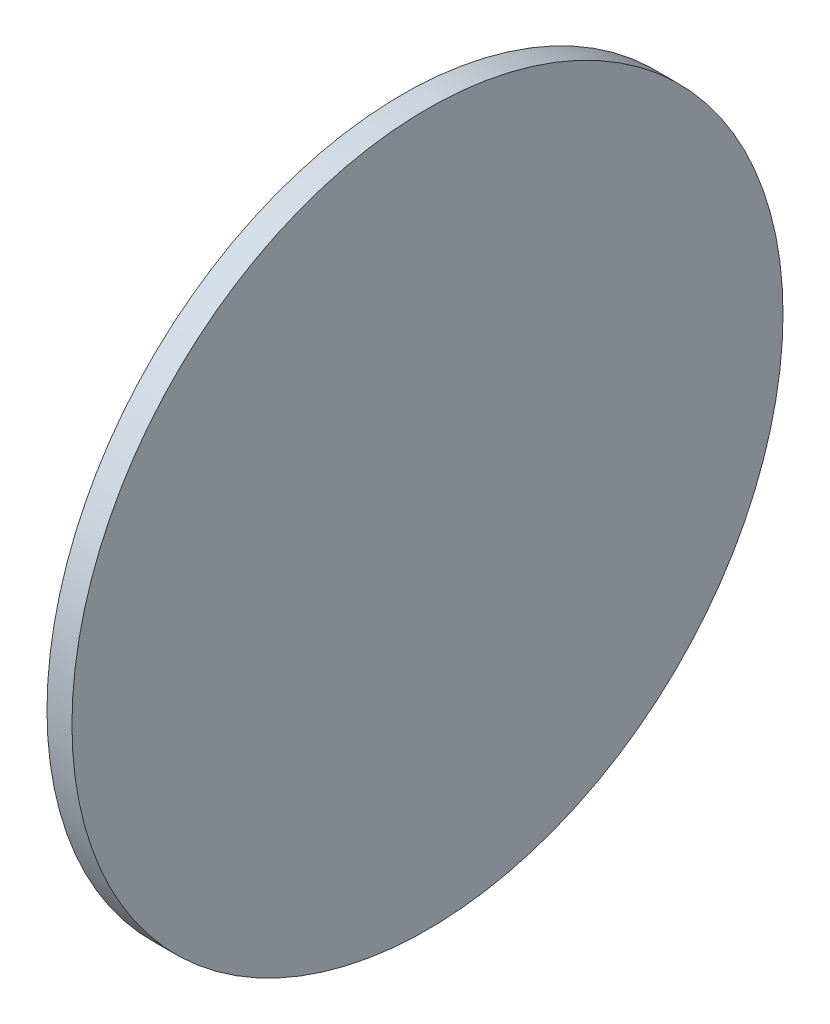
SolidWorks part; units mm, degrees
ref_plane "Front Plane" through (0, 0, 0) normal (0, 0, 1) x (1, 0, 0)
ref_plane "Top Plane" through (0, 0, 0) normal (0, 1, 0) x (1, 0, 0)
ref_plane "Right Plane" through (0, 0, 0) normal (1, 0, 0) x (0, 0, -1)
sketch "Sketch1" plane through (0, 0, 0) normal (1, 0, 0) x (0, 0, -1)
  circle A0 centre (0, 0) radius 71.25
  dimension "D1" = 142.5
extrude "Boss-Extrude1" add sketch "Sketch1" along normal blind 5
